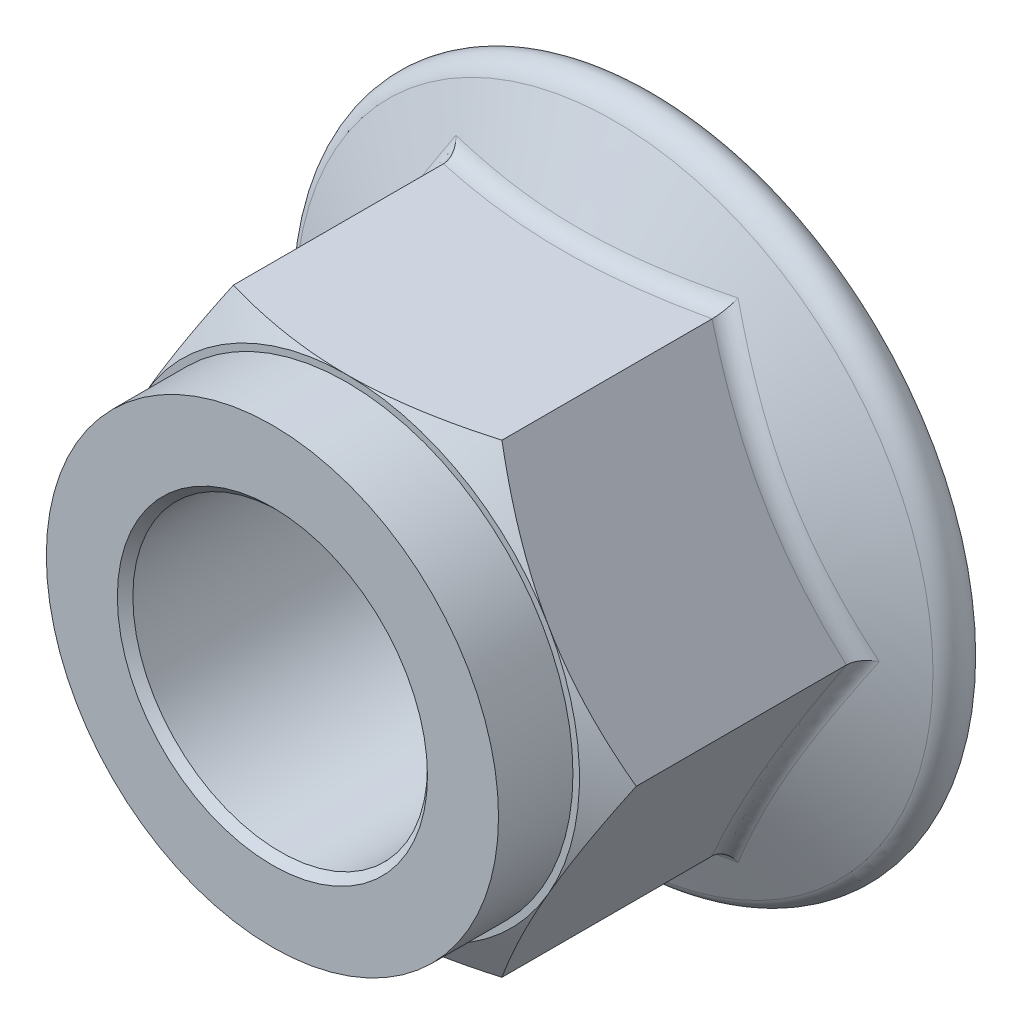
SolidWorks part; units mm, degrees
ref_plane "Front" through (0, 0, 0) normal (0, 0, 1) x (1, 0, 0)
ref_plane "Top" through (0, 0, 0) normal (0, 1, 0) x (1, 0, 0)
ref_plane "Right" through (0, 0, 0) normal (1, 0, 0) x (0, 0, -1)
sketch "Sketch1" plane through (0, 0, 0) normal (0, 0, 1) x (1, 0, 0)
  line L1 (8.6603, -15) -> (17.3205, 0)
  line L2 (17.3205, 0) -> (8.6603, 15)
  line L3 (8.6603, 15) -> (-8.6603, 15)
  line L4 (-8.6603, 15) -> (-17.3205, 0)
  line L5 (-17.3205, 0) -> (-8.6603, -15)
  line L6 (-8.6603, -15) -> (8.6603, -15)
  circle A0 centre (0, 0) radius 15 construction
  circle A1 centre (0, 0) radius 9.5
  dimension "xd" = 19
  dimension "s" = 30
extrude "BaseNut" add sketch "Sketch1" against normal blind 20
sketch "Sketch3" plane through (0.6779, 0, -16.6426) normal (0, 1, 0) x (0, 0, -1)
  line L0 (4.0352, 0.6779) -> (-19.0613, 0.6779) construction
  line L2 (-16.6426, 15.6779) -> (-15.3029, 17.9984)
  line L4 (-15.3029, 17.9984) -> (-16.6426, 17.9984)
  line L5 (-16.6426, 17.9984) -> (-16.6426, 15.6779)
  line L6 (-6.6426, 17.9984) -> (-6.6426, 14.238) construction
  line L8 (3.3574, 17.9984) -> (3.3574, 15.6779)
  line L9 (2.0176, 17.9984) -> (3.3574, 17.9984)
  line L10 (3.3574, 15.6779) -> (2.0176, 17.9984)
  line L12 (3.3574, 17.9984) -> (-16.6426, 17.9984) construction
  dimension "D1" = 30
  dimension "sq" = 30
revolve "Double-Chamfer" cut sketch "Sketch3" angle 360 about L0
sketch "Sketch4" plane through (4.6827, 0, -16.7173) normal (0, 1, 0) x (0, 0, -1)
  line L0 (-21.7744, 4.6827) -> (9.7398, 4.6827) construction
  line L2 (3.2827, 14.1827) -> (3.2827, 24.6327)
  line L3 (0.5185, 25.2455) -> (-4.6401, 14.1827)
  line L4 (3.2827, 14.1827) -> (-16.7173, 14.1827) construction
  line L11 (-4.6401, 14.1827) -> (3.2827, 14.1827)
  arc A0 (3.2827, 24.6327) -> (0.5185, 25.2455) centre (1.8327, 24.6327) ccw
  dimension "D3" = 65
  dimension "m1" = 20
  dimension "dc" = 42.8
  dimension "dw" = 39.9
revolve "Flange" add sketch "Sketch4" angle 360 about L0
fillet "FlangeFillet" radius 1.2 6 edges at (-15.0051, 4.0104, -14.8899) (10.9757, 10.9896, -14.8899) (-10.9757, -10.9896, -14.8899) (15.0051, -4.0104, -14.8899)
sketch "Sketch5" plane through (-5.1971, 0, -15.1971) normal (0, 1, 0) x (0, 0, -1)
  line L0 (3.5984, -5.1971) -> (-23.9926, -5.1971) construction
  line L2 (-15.1971, 4.8029) -> (-15.1971, 4.3029) construction
  line L4 (-15.1971, 4.3029) -> (-14.6971, 4.3029) construction
  line L6 (-14.6971, 4.3029) -> (-15.1971, 4.8029) construction
  line L7 (-5.1971, -0.987) -> (-5.1971, 4.3029) construction
  line L8 (4.3029, 4.3029) -> (4.8029, 4.8029)
  line L9 (4.8029, 4.3029) -> (4.3029, 4.3029)
  line L10 (4.8029, 4.8029) -> (4.8029, 4.3029)
  line L15 (4.8029, 4.3029) -> (-15.1971, 4.3029) construction
  dimension "da" = 20
  dimension "D2" = 45
revolve "EndChamfer1" cut sketch "Sketch5" angle 360 about L0
sketch "Sketch7" plane through (-3.0723, 10.3605, 0) normal (0, 0, 1) x (1, 0, 0)
  circle A1 centre (3.0723, -10.3605) radius 9.5 construction
  circle A2 centre (3.0723, -10.3605) radius 14.58
  circle A3 centre (3.0723, -10.3605) radius 9.5
  dimension "s1" = 29.16
extrude "TorqueElement" add sketch "Sketch7" along normal offset from surface (4.8 mm away) 24.8
sketch "Sketch8" plane through (-6.8843, 0, -16.8843) normal (0, 1, 0) x (0, 0, -1)
  line L0 (3.9311, -6.8843) -> (-27.6997, -6.8843) construction
  line L2 (-21.6843, 3.1157) -> (-21.1843, 2.6157)
  line L5 (-21.1843, 2.6157) -> (-21.6843, 2.6157)
  line L6 (-21.6843, 2.6157) -> (-21.6843, 3.1157)
  line L7 (-21.6843, 7.6957) -> (-21.6843, -21.4643) construction
  line L9 (2.6157, 2.6157) -> (-21.6843, 2.6157) construction
  dimension "D1" = 45
revolve "EndChamfer2" cut sketch "Sketch8" angle 360 about L0
sketch "Sketch9" plane through (0, 0, 0) normal (0, 1, 0) x (1, 0, 0)
  line L0 (0, 27.1353) -> (0, -11.1539) construction
  line L1 (9, 19.75) -> (9.5, 19.75)
  line L2 (9.5, 19.75) -> (9.933, 19.5)
  line L3 (9.933, 19.5) -> (9.5, 19.25)
  line L4 (9.5, 19.25) -> (9, 19.25)
  line L5 (9, 19.25) -> (9, 19.75)
  line L6 (-9.5, 19.5) -> (9.5, 19.5) construction
  dimension "D1" = 0.5
  dimension "D2" = 19
revolve "Cut-Revolve10" [suppressed] cut sketch "Sketch9" angle 360 about L0
pattern_linear "LPattern10" [suppressed] count 40 spacing 0.6 along (0, 0, -1)
equation "\"m1@Sketch4\" = \"m@BaseNut\""
equation "\"sq@Sketch3\" = \"s@Sketch1\""
equation "\"D2@Sketch9\" = \"xd@Sketch1\""
equation "\"D1@Sketch9\" = (  \"D2@ThreadCosmetic1\" - \"xd@Sketch1\" )  / 2"
equation "\"D3@LPattern10\" = \"D1@Sketch9\" * 1.2"
equation "\"D1@LPattern10\" =\"h@TorqueElement\" / \"D3@LPattern10\"-1"
